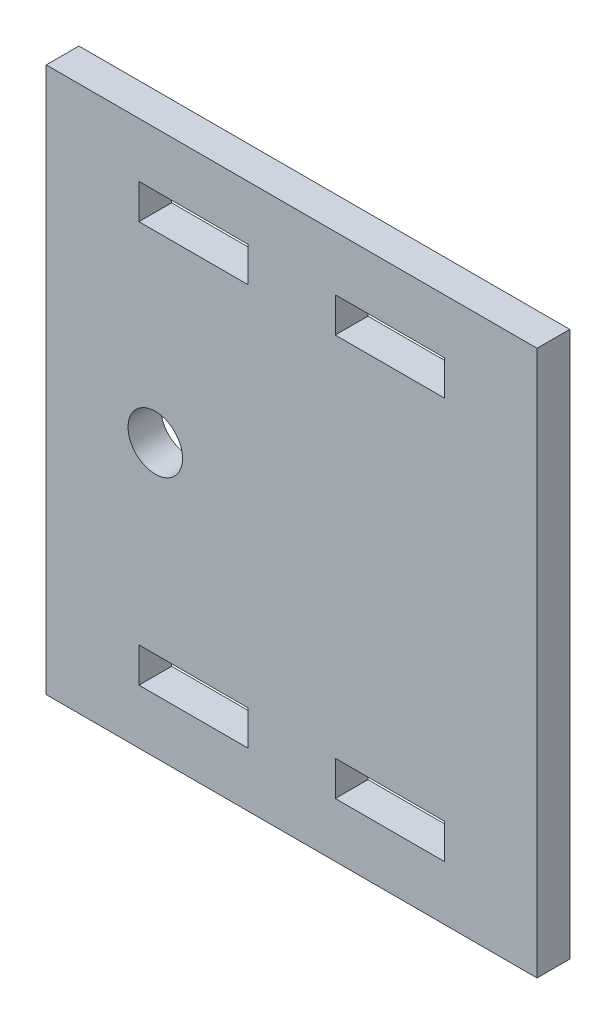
SolidWorks part; units mm, degrees
ref_plane "Plan de face" through (0, 0, 0) normal (0, 0, 1) x (1, 0, 0)
ref_plane "Plan de dessus" through (0, 0, 0) normal (0, 1, 0) x (1, 0, 0)
ref_plane "Plan de droite" through (0, 0, 0) normal (1, 0, 0) x (0, 0, -1)
sketch "Esquisse1" plane through (0, 0, 0) normal (0, 0, 1) x (1, 0, 0)
  line L0 (0, 0) -> (63.1937, 0) construction
  line L1 (-10, 25) -> (35, 25)
  line L2 (-10, 25) -> (-10, -25)
  line L3 (-10, -25) -> (35, -25)
  line L4 (35, 25) -> (35, -25)
  line L5 (-1.5, 20) -> (8.5, 20)
  line L6 (-1.5, 20) -> (-1.5, 16.8)
  line L7 (-1.5, 16.8) -> (8.5, 16.8)
  line L8 (8.5, 20) -> (8.5, 16.8)
  line L9 (16.5, 20) -> (26.5, 20)
  line L10 (16.5, 20) -> (16.5, 16.8)
  line L11 (16.5, 16.8) -> (26.5, 16.8)
  line L12 (26.5, 20) -> (26.5, 16.8)
  line L13 (16.5, -20) -> (26.5, -20)
  line L14 (26.5, -20) -> (26.5, -16.8)
  line L15 (16.5, -16.8) -> (26.5, -16.8)
  line L16 (16.5, -20) -> (16.5, -16.8)
  line L17 (8.5, -20) -> (8.5, -16.8)
  line L18 (-1.5, -20) -> (8.5, -20)
  line L19 (-1.5, -20) -> (-1.5, -16.8)
  line L20 (-1.5, -16.8) -> (8.5, -16.8)
  circle A0 centre (0, 0) radius 2.5
  dimension "D5" = 5
  dimension "D1" = 45
  dimension "D2" = 10
  dimension "D3" = 50
  dimension "D4" = 25
  dimension "D6" = 3.2
  dimension "D7" = 10
  dimension "D8" = 8
  dimension "D9" = 5
  dimension "D10" = 8.5
extrude "Boss.-Extru.1" add sketch "Esquisse1" along normal blind 3
